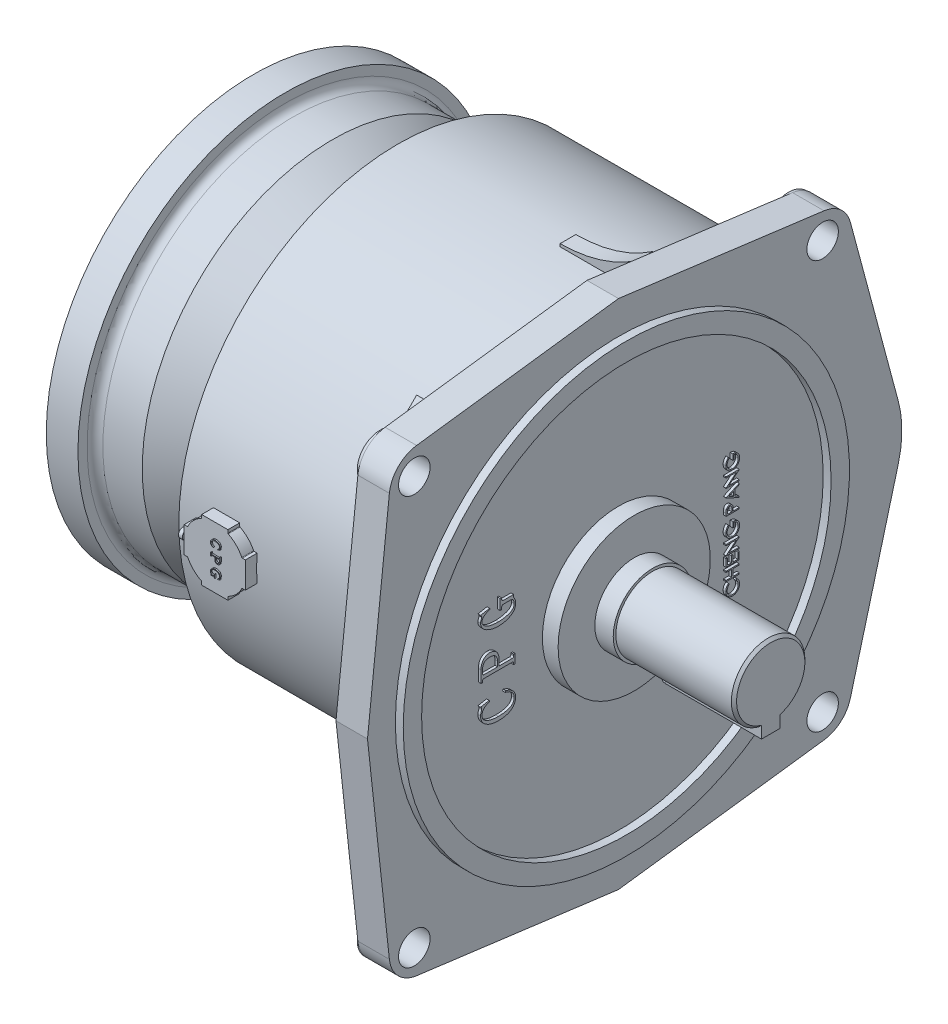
SolidWorks part; units mm, degrees
ref_plane "前视基准面" through (0, 0, 0) normal (0, 0, 1) x (1, 0, 0)
ref_plane "上视基准面" through (0, 0, 0) normal (0, 1, 0) x (1, 0, 0)
ref_plane "右视基准面" through (0, 0, 0) normal (1, 0, 0) x (0, 0, -1)
sketch "草图1" plane through (0, 0, 0) normal (0, 1, 0) x (1, 0, 0)
  line L0 (0, 0) -> (15.7361, 0) construction
  line L1 (0, 0) -> (0, -14)
  line L2 (0, -14) -> (-45, -14)
  line L3 (-45, -14) -> (-45, -15)
  line L4 (-45, -15) -> (-52, -15)
  line L5 (-55, -29) -> (-55, -85)
  line L6 (-55, -85) -> (-58, -85)
  line L7 (-58, -85) -> (-58, 0)
  line L8 (-58, 0) -> (0, 0)
  line L9 (-55, -29) -> (-52, -29)
  line L10 (-52, -29) -> (-52, -15)
  dimension "D1" = 45
  dimension "D2" = 28
  dimension "D3" = 30
  dimension "D4" = 3
  dimension "D5" = 170
  dimension "D6" = 58
  dimension "D7" = 3
  dimension "D8" = 58
revolve "旋转1" add sketch "草图1" angle 360 about L0
sketch "草图2" plane through (0, 0, 0) normal (0, 1, 0) x (1, 0, 0)
  line L0 (8.0167, 23) -> (-70, 23) construction
  line L1 (-58, 85) -> (-58, -85) construction
  line L4 (-70, 23) -> (-70, -60.5)
  line L5 (-70, -60.5) -> (-155, -60.5)
  line L6 (-155, -60.5) -> (-155, 23)
  line L11 (-70, 23) -> (-155, 23)
  dimension "D1" = 23
  dimension "D2" = 12
  dimension "D3" = 167
  dimension "D5" = 85
revolve "旋转2" add sketch "草图2" angle 360 about L0
sketch "草图12" plane through (-70, 0, 0) normal (1, 0, 0) x (0, 0, -1)
  line L0 (0, -97.5) -> (86.267, -86.267)
  line L1 (-86.267, -86.267) -> (0, -97.5)
  line L2 (-86.267, -86.267) -> (-95.6178, 0)
  line L3 (-86.267, 86.267) -> (0, 97.5)
  line L4 (86.267, -86.267) -> (109.3822, 0)
  line L5 (-95.6178, 0) -> (-86.267, 86.267)
  line L6 (0, 97.5) -> (86.267, 86.267)
  line L7 (109.3822, 0) -> (86.267, 86.267)
  line L8 (167.8979, 0) -> (-107.2143, 0) construction
  line L9 (0, 107.5085) -> (0, -103.3164) construction
  line L10 (0, 0) -> (-77.7817, 77.7817) construction
  line L11 (0, 0) -> (77.7817, 77.7817) construction
  circle A0 centre (0, 0) radius 110 construction
  circle A1 centre (-77.7817, 77.7817) radius 6
  circle A2 centre (77.7817, 77.7817) radius 6
  circle A3 centre (77.7817, -77.7817) radius 6
  circle A4 centre (-77.7817, -77.7817) radius 6
  dimension "D3" = 220
  dimension "D4" = 12
  dimension "D5" = 15
  dimension "D1" = 195
  dimension "D2" = 205
  dimension "D6" = 12
extrude "拉伸8" add sketch "草图12" along normal up to surface (12 mm away)
sketch "草图5" plane through (0, 0, 0) normal (0, 1, 0) x (1, 0, 0)
  line L0 (0, -3.5) -> (-36.5, -3.5)
  line L1 (0, -14) -> (0, 14) construction
  line L2 (-36.5, 3.5) -> (0, 3.5)
  line L3 (0, 3.5) -> (0, -3.5)
  line L4 (31.1, -13.7955) -> (31.1, 19.6443) construction
  arc A0 (-36.5, -3.5) -> (-36.5, 3.5) centre (-36.5, 0) cw
  dimension "D2" = 40
  dimension "D1" = 7
  dimension "D3" = 31.1
extrude "拉伸4" add sketch "草图5" against normal blind 17.1
fillet "圆角4" radius 12 4 edges at (-64, 86.267, 86.267) (-64, 86.267, -86.267) (-64, -86.267, -86.267) (-64, -86.267, 86.267)
fillet "圆角5" radius 40 1 edges at (-64, 0, -109.3822)
chamfer "倒角1" distance 1 angle 45 1 edges at (0, 14, 0)
sketch "草图18" plane through (-70, 0, 0) normal (-1, 0, 0) x (0, 0, 1)
  line L0 (-23, 0) -> (65.9169, -88.9169) construction
  line L1 (0, -85.25) -> (0, 85.25) construction
  line L2 (76.9039, -87.4862) -> (0, -97.5) construction
  line L3 (36.0434, -59.0434) -> (65.9169, -88.9169)
  line L4 (-23, 0) -> (-77.7817, -77.7817) construction
  line L5 (-76.7543, -75.4044) -> (-71.081, -68.2676)
  line L7 (-23, 0) -> (-23, -94.5051) construction
  line L8 (0, -97.5) -> (-78.3038, -87.3039) construction
  line L9 (-23, -83.5) -> (-23, -94.5051)
  circle A0 centre (-23, 0) radius 83.5 construction
  arc A1 (-88.3455, -78.5102) -> (-78.3038, -87.3039) centre (-76.7543, -75.4044) ccw construction
  circle A3 centre (-23, 0) radius 83.5 construction
  dimension "D1" = 45
  dimension "D2" = 9.117
  dimension "D4" = 42.2474
  dimension "D5" = 11.0051
ref_plane "基准面7" through (-71, 0, 0) normal (1, 0, 0) x (0, 0, -1)
sketch "草图13" plane through (-70, 0, 0) normal (1, 0, 0) x (0, 0, -1)
  line L5 (0, 0) -> (107.7406, 0) construction
  circle A1 centre (77.7817, 77.7817) radius 9.4101
  circle A3 centre (77.7817, 77.7817) radius 6
  circle A4 centre (77.7817, -77.7817) radius 6 construction
  circle A5 centre (77.7817, -77.7817) radius 6
  circle A7 centre (-77.7817, -77.7817) radius 6
  arc A10 (78.3038, -87.3039) -> (88.3455, -78.5102) centre (76.7543, -75.4044) ccw construction
  circle A11 centre (-77.7817, -77.7817) radius 6 construction
  arc A12 (-87.2845, -76.8798) -> (-76.9039, -87.4862) centre (-75.3544, -75.5867) ccw construction
  circle A14 centre (-77.7817, 77.7817) radius 6
  circle A15 centre (-77.7817, 77.7817) radius 8.7273
  circle A20 centre (-77.7817, -77.7817) radius 8.7273
  circle A21 centre (77.7817, -77.7817) radius 9.4101
  point P8 (23, 0)
extrude "拉伸9" add sketch "草图13" against normal up to surface (1 mm away)
sketch "草图14" plane through (0, 0, 0) normal (0, 1, 0) x (1, 0, 0)
  line L0 (-70, 23) -> (-155, 23) construction
  line L5 (-70, -76.9039) -> (-70, 0) construction
  line L6 (-100.2474, -60.5) -> (-100.2474, -61.5)
  line L7 (-70, -90.7474) -> (-71, -90.7474)
  line L9 (-70, -60.5) -> (-155, -60.5) construction
  arc A0 (-71, -90.7474) -> (-100.2474, -61.5) centre (-100.2474, -90.7474) ccw
  dimension "D1" = 113.7474
  dimension "D2" = 1
  dimension "D3" = 1
rib "筋17" sketch "草图14" sketch "草图14" thickness 6 extrusion direction parallel to sketch draft on no parameters "D1"=6
pattern_circular "阵列(圆周)16" count 8 over 360 about axis through (0, 0, -23) along (1, 0, 0) of "筋17"
ref_plane "基准面8" through (0, 0, -23) normal (0, 0, 1) x (1, 0, 0)
sketch "草图17" plane through (0, 0, -23) normal (0, 0, 1) x (1, 0, 0)
  line L0 (-70, -93.5051) -> (-71, -93.5051)
  line L1 (-70, -87.4862) -> (-70, -97.5) construction
  line L2 (-100.2474, -83.5) -> (-100.2474, -84.5)
  line L4 (-155, -83.5) -> (-70, -83.5) construction
  line L6 (-100.2474, -61.8718) -> (-100.2474, -57.6292) construction
  arc A0 (-71, -93.5051) -> (-100.2474, -84.5) centre (-100.2474, -136.4984) ccw
  dimension "D1" = 10.0051
  dimension "D2" = 1
  dimension "D3" = 1
rib "筋24" sketch "草图17" sketch "草图17" thickness 6 extrusion direction parallel to sketch draft on no parameters "D1"=6
mirror "镜向1" about plane through (0, 0, 0) normal (0, 1, 0) of "筋24"
sketch "草圖1" plane through (0, 0, 0) normal (0, 1, 0) x (1, 0, 0)
  line L0 (-212.4394, 23) -> (-155, 23)
  line L2 (-37.3334, 23) -> (-274.8833, 23) construction
  line L4 (-165, -37) -> (-170, -37)
  line L5 (-170, -37) -> (-189.9394, -49.5)
  line L6 (-189.9394, -49.5) -> (-204.9394, -49.5)
  line L7 (-207.9394, -52.5) -> (-207.9394, -56)
  line L8 (-207.9394, -56) -> (-220, -56)
  line L9 (-220, -56) -> (-220, -33)
  line L10 (-219, -32) -> (-215.9394, -32)
  line L11 (-215.9394, -32) -> (-215.9394, -27.0871)
  line L12 (-194.9394, -16.5606) -> (-194.9394, -11)
  line L13 (-197.9394, -8) -> (-212.9394, -8)
  line L14 (-213.9394, -7) -> (-213.9394, 2)
  line L15 (-213.9394, 2) -> (-212.7394, 2)
  line L16 (-212.4394, 2.3) -> (-212.4394, 23)
  line L17 (-215.8531, -26.988) -> (-194.9394, -24.0869)
  line L18 (-155, -60.5) -> (-165, -60.5)
  line L19 (-165, -60.5) -> (-165, -37)
  line L20 (-155, -60.5) -> (-155, 23)
  arc A0 (-204.9394, -49.5) -> (-207.9394, -52.5) centre (-204.9394, -52.5) ccw
  arc A1 (-194.9394, -24.0869) -> (-193.6855, -19.0001) centre (-195.3269, -21.2934) ccw
  arc A2 (-219, -32) -> (-220, -33) centre (-219, -33) ccw
  arc A3 (-215.8531, -26.988) -> (-215.9394, -27.0871) centre (-215.8394, -27.0871) ccw
  arc A4 (-193.6855, -19.0001) -> (-194.9394, -16.5606) centre (-191.9394, -16.5606) cw
  arc A5 (-194.9394, -11) -> (-197.9394, -8) centre (-197.9394, -11) ccw
  arc A6 (-212.9394, -8) -> (-213.9394, -7) centre (-212.9394, -7) cw
  arc A7 (-212.7394, 2) -> (-212.4394, 2.3) centre (-212.7394, 2.3) ccw
  point P27 (-220, -32)
  point P30 (-215.9394, -27)
  point P33 (-194.9394, -18.5)
  point P38 (-213.9394, -8)
  point P41 (-213.9394, 3)
  dimension "D9" = 158
  dimension "D19" = 23
  dimension "D2" = 120
  dimension "D3" = 55
  dimension "D4" = 220
  dimension "D5" = 165
  dimension "D8" = 145
  dimension "D10" = 110
revolve "旋轉1" add sketch "草圖1" angle 360 about L2
sketch "草圖2" plane through (-220, 0, 0) normal (-1, 0, 0) x (0, 0, 1)
  line L0 (-107.0945, 0) -> (65.8288, 0) construction
  line L1 (-23, 84.2191) -> (-23, -84.9666) construction
  circle A0 centre (-23, 0) radius 65 construction
  circle A1 centre (-68.9619, 45.9619) radius 4
  circle A2 centre (22.9619, 45.9619) radius 4
  circle A3 centre (22.9619, -45.9619) radius 4
  circle A4 centre (-68.9619, -45.9619) radius 4
  dimension "D1" = 130
  dimension "D2" = 8
extrude "伸長1" cut sketch "草圖2" against normal blind 25
sketch "草圖3" plane through (-220, 0, 0) normal (-1, 0, 0) x (0, 0, 1)
  line L0 (-23, 0) -> (-89.2638, 0) construction
  line L1 (-84.1334, 25.778) -> (-64.4295, 5.5251)
  line L2 (-84.1334, -25.2495) -> (-64.3656, -5.4747)
  line L3 (-63.4241, 10.7256) -> (-70.4952, 17.7967)
  line L4 (-40.7967, 47.4952) -> (-33.7256, 40.4241)
  line L5 (-69.7566, 35.0893) -> (-58.0893, 46.7566)
  line L6 (-48.778, 61.1334) -> (-29.0033, 41.3656)
  line L7 (2.2495, 61.1334) -> (-18.0034, 41.4295)
  line L8 (11.5607, 46.7566) -> (23.228, 35.0893)
  line L10 (23.9666, 17.7967) -> (16.8955, 10.7256)
  line L11 (37.6048, 25.778) -> (17.837, 6.0033)
  line L12 (37.6048, -25.2495) -> (17.9009, -4.9966)
  line L13 (23.228, -34.5607) -> (11.5607, -46.228)
  line L15 (-5.7319, -46.9666) -> (-12.803, -39.8955)
  line L16 (2.2495, -60.6048) -> (-17.5253, -40.837)
  line L17 (-48.778, -60.6048) -> (-28.5251, -40.9009)
  line L18 (-58.0893, -46.228) -> (-69.7566, -34.5607)
  line L20 (-70.4952, -17.2681) -> (-63.4241, -10.197)
  line L22 (-12.803, 40.4241) -> (-5.7319, 47.4952)
  line L24 (16.8955, -10.197) -> (23.9666, -17.2681)
  line L29 (-33.7256, -39.8955) -> (-40.7967, -46.9666)
  arc A0 (-84.1334, 25.778) -> (-84.1334, -25.2495) centre (-23.2643, 0.2643) ccw
  arc A1 (-33.7256, 40.4241) -> (-63.4241, 10.7256) centre (-23.2643, 0.2643) ccw
  arc A2 (16.8955, 10.7256) -> (-12.803, 40.4241) centre (-23.2643, 0.2643) ccw
  arc A3 (-64.4295, 5.5251) -> (-64.3656, -5.4747) centre (-23.2643, 0.2643) ccw
  arc A4 (2.2495, 61.1334) -> (-48.778, 61.1334) centre (-23.2643, 0.2643) ccw
  arc A5 (-18.0034, 41.4295) -> (-29.0033, 41.3656) centre (-23.2643, 0.2643) ccw
  arc A6 (-12.803, -39.8955) -> (16.8955, -10.197) centre (-23.2643, 0.2643) ccw
  arc A7 (37.6048, -25.2495) -> (37.6048, 25.778) centre (-23.2643, 0.2643) ccw
  arc A8 (17.9009, -4.9966) -> (17.837, 6.0033) centre (-23.2643, 0.2643) ccw
  arc A9 (-63.4241, -10.197) -> (-33.7256, -39.8955) centre (-23.2643, 0.2643) ccw
  arc A10 (-48.778, -60.6048) -> (2.2495, -60.6048) centre (-23.2643, 0.2643) ccw
  arc A11 (-28.5251, -40.9009) -> (-17.5253, -40.837) centre (-23.2643, 0.2643) ccw
  spline S0 degree 2 poles (-70.4952, 17.7967) (-75.3355, 26.6584) (-69.7566, 35.0893) knots 0 0 0 1 1 1
  spline S1 degree 2 poles (-40.7967, 47.4952) (-49.6584, 52.3355) (-58.0893, 46.7566) knots 0 0 0 1 1 1
  spline S2 degree 2 poles (23.9666, 17.7967) (28.807, 26.6584) (23.228, 35.0893) knots 0 0 0 1 1 1
  spline S3 degree 2 poles (-5.7319, 47.4952) (3.1298, 52.3355) (11.5607, 46.7566) knots 0 0 0 1 1 1
  spline S4 degree 2 poles (-5.7319, -46.9666) (3.1298, -51.807) (11.5607, -46.228) knots 0 0 0 1 1 1
  spline S5 degree 2 poles (23.9666, -17.2681) (28.807, -26.1298) (23.228, -34.5607) knots 0 0 0 1 1 1
  spline S6 degree 2 poles (-70.4952, -17.2681) (-75.3355, -26.1298) (-69.7566, -34.5607) knots 0 0 0 1 1 1
  spline S7 degree 2 poles (-40.7967, -46.9666) (-49.6584, -51.807) (-58.0893, -46.228) knots 0 0 0 1 1 1
extrude "伸長2" cut sketch "草圖3" against normal blind 39
sketch "草圖4" plane through (-181, 0, 0) normal (-1, 0, 0) x (0, 0, 1)
  circle A0 centre (-23, 0) radius 51.5 construction
  circle A1 centre (-59.416, 36.416) radius 3
  circle A2 centre (13.416, 36.416) radius 3
  circle A3 centre (13.416, -36.416) radius 3
  circle A4 centre (-59.416, -36.416) radius 3
  dimension "D1" = 103
  dimension "D2" = 6
extrude "伸長3" cut sketch "草圖4" against normal blind 11
sketch "草圖5" plane through (-212.4394, 0, 0) normal (-1, 0, 0) x (0, 0, 1)
  line L0 (-23, -16.5253) -> (-23, 16) construction
  line L3 (-40.7414, 0) -> (-6.4158, 0) construction
  line L5 (-15.7, 2) -> (-15.7, -2)
  line L6 (-15.7, -2) -> (-17.8765, -2)
  line L7 (-15.7, 2) -> (-17.8765, 2)
  circle A0 centre (-23, 0) radius 12.5 construction
  arc A1 (-17.8765, 2) -> (-17.8765, -2) centre (-23, 0) ccw
  dimension "D1" = 25
  dimension "D2" = 11
  dimension "D3" = 7.3
  dimension "D4" = 4
extrude "伸長4" cut sketch "草圖5" against normal blind 28
sketch "草圖6" plane through (-212.4394, 0, 0) normal (-1, 0, 0) x (0, 0, 1)
  line L0 (-15.7, -2) -> (-17.8765, -2) construction
  line L1 (-15.7, 2) -> (-15.7, -2) construction
  line L2 (-15.7, 2) -> (-17.8765, 2) construction
  line L3 (-15.7, -2) -> (-17.8765, -2)
  line L4 (-15.7, 2) -> (-15.7, -2)
  line L5 (-15.7, 2) -> (-17.8765, 2)
  circle A0 centre (-23, 0) radius 12.5 construction
  circle A1 centre (-23, 0) radius 12.5
  arc A2 (-17.8765, 2) -> (-17.8765, -2) centre (-23, 0) ccw construction
  arc A3 (-17.8765, 2) -> (-17.8765, -2) centre (-23, 0) ccw
extrude "伸長5" add sketch "草圖6" along normal blind 1
sketch "草圖7" plane through (-55, 0, 0) normal (1, 0, 0) x (0, 0, -1)
  circle A1 centre (0, 0) radius 29 construction
  circle A2 centre (0, 0) radius 29
  circle A3 centre (0, 0) radius 78
  dimension "D1" = 156
extrude "伸長6" cut sketch "草圖7" against normal blind 3
sketch "草圖8"
  dimension "D1" = 40
  dimension "D2" = 45
extrude "伸長7" add sketch "草圖8" along normal blind 1
ref_plane "平面1" through (0, 0, 64.8) normal (0, 0, 1) x (1, 0, 0)
sketch "草圖9" plane through (0, 0, 64.8) normal (0, 0, 1) x (1, 0, 0)
  line L0 (-152, 11.65) -> (-142, 11.65)
  line L1 (-152, 11.65) -> (-152, 10.5119)
  line L2 (-142, 11.65) -> (-142, 10.5119)
  line L3 (-152, -10.5119) -> (-152, -11.65)
  line L4 (-142, -10.5119) -> (-142, -11.65)
  line L5 (-158.65, 5) -> (-157.5119, 5)
  line L6 (-158.65, -5) -> (-157.5119, -5)
  line L7 (-158.65, -5) -> (-158.65, 5)
  line L8 (-152, -11.65) -> (-152, -10.5119)
  line L9 (-142, -11.65) -> (-142, -10.5119)
  line L10 (-142, -11.65) -> (-152, -11.65)
  line L11 (-135.35, -5) -> (-136.4881, -5)
  line L12 (-135.35, 5) -> (-136.4881, 5)
  line L13 (-135.35, 5) -> (-135.35, -5)
  arc A0 (-152.1383, 10.2882) -> (-157.2882, 5.1383) centre (-147, 0) ccw
  arc A1 (-152.1383, 10.2882) -> (-152, 10.5119) centre (-152.25, 10.5119) ccw
  arc A2 (-142, 10.5119) -> (-141.8617, 10.2882) centre (-141.75, 10.5119) ccw
  arc A3 (-157.5119, 5) -> (-157.2882, 5.1383) centre (-157.5119, 5.25) ccw
  arc A4 (-157.2882, -5.1383) -> (-157.5119, -5) centre (-157.5119, -5.25) ccw
  arc A5 (-152, -10.5119) -> (-152.1383, -10.2882) centre (-152.25, -10.5119) ccw
  arc A6 (-141.8617, -10.2882) -> (-142, -10.5119) centre (-141.75, -10.5119) ccw
  arc A7 (-136.4881, -5) -> (-136.7118, -5.1383) centre (-136.4881, -5.25) ccw
  arc A8 (-136.7118, 5.1383) -> (-136.4881, 5) centre (-136.4881, 5.25) ccw
  arc A9 (-136.7118, 5.1383) -> (-141.8617, 10.2882) centre (-147, 0) ccw
  arc A10 (-157.2882, -5.1383) -> (-152.1383, -10.2882) centre (-147, 0) ccw
  arc A11 (-141.8617, -10.2882) -> (-136.7118, -5.1383) centre (-147, 0) ccw
extrude "伸長8" add sketch "草圖9" against normal blind 4.5 separate body contours A6 A11 A7 L11 L13 L12 A8 A9 A2 L2 L0 L1 A1 A0 A3 L5 L7 L6 A4 A10 A5 L3 L10 L4
sketch "草圖10"
extrude "伸長9" add sketch "草圖10" along normal blind 0.5
sketch "草圖11" plane through (0, 0, 0) normal (0, 1, 0) x (1, 0, 0)
  line L0 (-161.2957, -62.55) -> (-153.2957, -62.55)
  line L1 (-161.2957, -62.55) -> (-161.2957, -60.75)
  line L2 (-159.7957, -61.5) -> (-159.7957, -60.75)
  line L3 (-107.25, -64.8) -> (107.25, -64.8) construction
  line L13 (-157.7957, -61.5) -> (-153.2957, -61.75)
  line L15 (-159.7957, -61.5) -> (-157.7957, -61.5)
  line L23 (-161.2957, -60.75) -> (-159.7957, -60.75)
  line L24 (-157.7957, -62.55) -> (-157.7957, -61.5)
  line L25 (-153.2957, -62.55) -> (-153.2957, -61.75)
  dimension "D1" = 2.25
revolve "旋轉2" add sketch "草圖11" angle 360 about L0
equation "\"D3@草图1\"=\"D2@草图1\"+2"
equation "\"D1@拉伸4\" = \"D3@草图5\"-\"D2@草图1\"/2"
equation "\"D5@草图1\" = \"D1@草圖7\"+14"
equation "\"D3@草圖1\" = \"D4@草圖1\"-\"D5@草圖1\""
